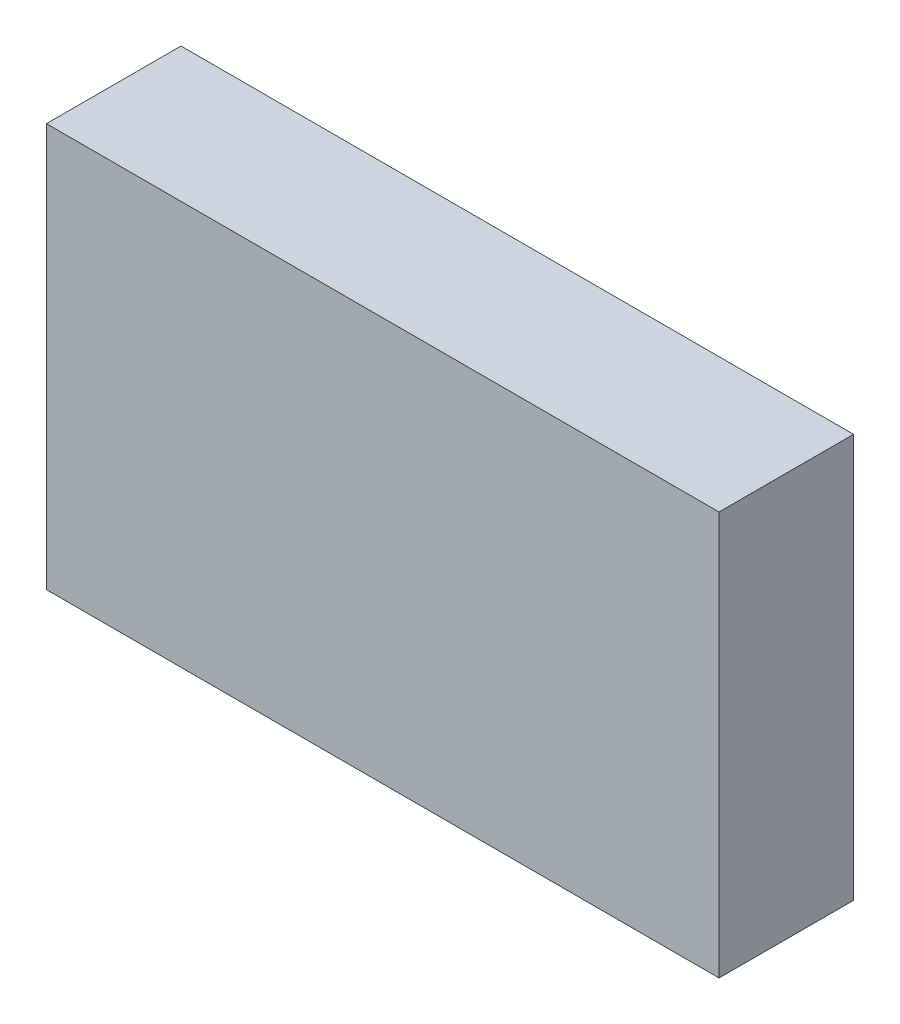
SolidWorks part; units mm, degrees
ref_plane "正面" through (0, 0, 0) normal (0, 0, 1) x (1, 0, 0)
ref_plane "平面" through (0, 0, 0) normal (0, 1, 0) x (1, 0, 0)
ref_plane "右側面" through (0, 0, 0) normal (1, 0, 0) x (0, 0, -1)
sketch "ｽｹｯﾁ1" plane through (0, 0, 0) normal (0, 0, 1) x (1, 0, 0)
  line L1 (0, 0) -> (50, 0)
  line L2 (0, 0) -> (0, 30)
  line L3 (0, 30) -> (50, 30)
  line L4 (50, 0) -> (50, 30)
  line L5 (0, 0) -> (50, 30) construction
  line L6 (0, 30) -> (50, 0) construction
  point P0 (25, 15)
  point P6 (0, 0)
  point P7 (0, 0)
  dimension "D1" = 50
  dimension "D2" = 30
extrude "ﾎﾞｽ - 押し出し1" add sketch "ｽｹｯﾁ1" along normal blind 10
